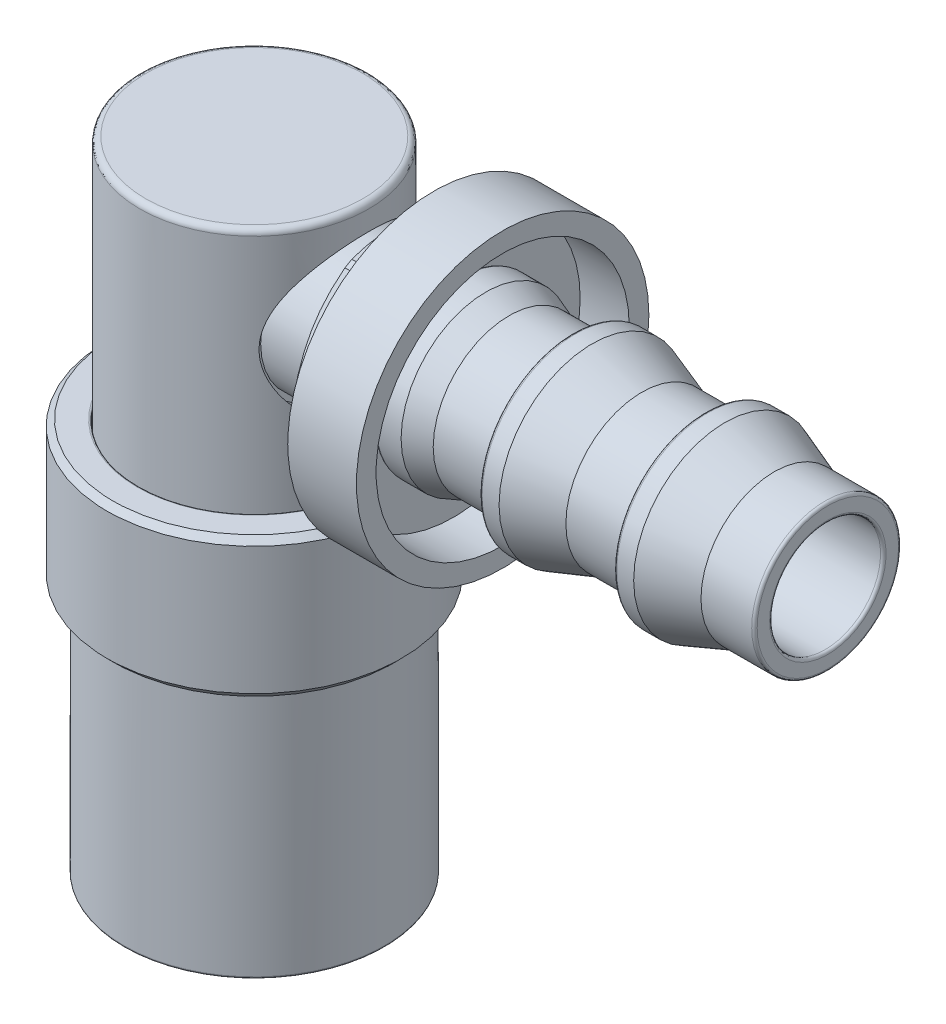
SolidWorks part; units mm, degrees
other "Body"
ref_plane "Front Plane" through (0, 0, 0) normal (0, 0, 1) x (1, 0, 0)
ref_plane "Top Plane" through (0, 0, 0) normal (0, 1, 0) x (1, 0, 0)
ref_plane "Right Plane" through (0, 0, 0) normal (1, 0, 0) x (0, 0, -1)
imported_body "SC200S"
imported_body "PL-BARB"
imported_body "BARB"
imported_body "BODY"
imported_body "SLEEVE"
sketch "Sketch1" plane through (0, 0, 0) normal (0, 0, 1) x (1, 0, 0)
  line L0 (-4.7752, 8.1191) -> (-3.175, 7.1952)
  line L1 (-3.175, 7.1952) -> (-3.175, 2.3876)
  line L2 (-3.175, 2.3876) -> (-4.7752, 0.7874)
  line L3 (-4.7752, 0.7874) -> (-4.7752, 8.1191)
  line L4 (-5.0546, 8.2804) -> (-4.7752, 8.1191) construction
  line L5 (-4.7752, 0.7874) -> (-5.5626, 0) construction
  line L6 (0, -1.2294) -> (0, 6.0894) construction
  line L7 (0, 8.1191) -> (0, 0.7874) construction
  dimension "D1" = 6.35
revolve "Revolve1" add sketch "Sketch1" angle 360 about L6
sketch "Sketch2" plane through (0, 0, 0) normal (0, -1, 0) x (1, 0, 0)
  line L1 (0, 5.2793) -> (-4.572, 2.6396)
  line L2 (-4.572, 2.6396) -> (-4.572, -2.6396)
  line L3 (-4.572, -2.6396) -> (0, -5.2793)
  line L4 (0, -5.2793) -> (4.572, -2.6396)
  line L5 (4.572, -2.6396) -> (4.572, 2.6396)
  line L6 (4.572, 2.6396) -> (0, 5.2793)
  circle A0 centre (0, 0) radius 4.572 construction
  dimension "D1" = 9.144
extrude "Cut-Extrude1" cut sketch "Sketch2" against normal up to surface (9.3379 mm away)
